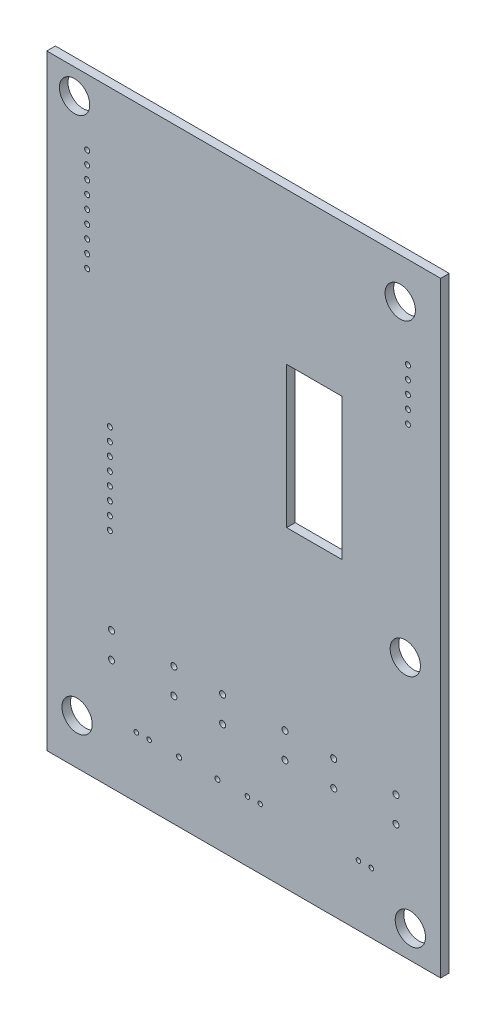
SolidWorks part; units mm, degrees
ref_plane "Plan de face" through (0, 0, 0) normal (0, 0, 1) x (1, 0, 0)
ref_plane "Plan de dessus" through (0, 0, 0) normal (0, 1, 0) x (1, 0, 0)
ref_plane "Plan de droite" through (0, 0, 0) normal (1, 0, 0) x (0, 0, -1)
sketch "Esquisse2" plane through (0, 0, 0) normal (0, 0, 1) x (1, 0, 0)
  line L0 (85.5, -81) -> (85.5, -53)
  line L1 (85.5, -53) -> (74.5, -53)
  line L2 (74.5, -53) -> (74.5, -81)
  line L3 (74.5, -81) -> (85.5, -81)
  line L4 (27, -143) -> (27, -23)
  line L5 (27, -23) -> (105, -23)
  line L6 (105, -23) -> (105, -143)
  line L7 (105, -143) -> (27, -143)
  circle A0 centre (97, -31) radius 3
  circle A1 centre (98.52, -41.08) radius 0.5
  circle A2 centre (98.52, -43.62) radius 0.5
  circle A3 centre (98.52, -46.16) radius 0.5
  circle A4 centre (98.52, -48.7) radius 0.5
  circle A5 centre (98.52, -51.24) radius 0.5
  circle A6 centre (32.5, -28) radius 3
  circle A7 centre (35, -36) radius 0.5
  circle A8 centre (35, -38.54) radius 0.5
  circle A9 centre (35, -41.08) radius 0.5
  circle A10 centre (35, -43.62) radius 0.5
  circle A11 centre (35, -46.16) radius 0.5
  circle A12 centre (35, -48.7) radius 0.5
  circle A13 centre (35, -51.24) radius 0.5
  circle A14 centre (35, -53.78) radius 0.5
  circle A15 centre (35, -56.32) radius 0.5
  circle A16 centre (39.49, -81.21) radius 0.5
  circle A17 centre (98, -91.5) radius 3
  circle A18 centre (96.17, -115.96) radius 0.6
  circle A19 centre (96.16, -121.04) radius 0.6
  circle A20 centre (99, -137.5) radius 3
  circle A21 centre (91.265, -131) radius 0.45
  circle A22 centre (88.725, -131) radius 0.45
  circle A23 centre (83.82, -115.95) radius 0.6
  circle A24 centre (83.83, -121.04) radius 0.6
  circle A25 centre (74.17, -115.96) radius 0.6
  circle A26 centre (74.16, -121.04) radius 0.6
  circle A27 centre (69.265, -131) radius 0.45
  circle A28 centre (66.725, -131) radius 0.45
  circle A29 centre (39.49, -83.75) radius 0.5
  circle A30 centre (39.49, -86.29) radius 0.5
  circle A31 centre (39.49, -88.83) radius 0.5
  circle A32 centre (39.49, -91.37) radius 0.5
  circle A33 centre (39.49, -93.91) radius 0.5
  circle A34 centre (39.49, -96.45) radius 0.5
  circle A35 centre (39.49, -98.99) radius 0.5
  circle A36 centre (61.82, -115.95) radius 0.6
  circle A37 centre (61.83, -121.04) radius 0.6
  circle A38 centre (52.17, -115.96) radius 0.6
  circle A39 centre (52.16, -121.04) radius 0.6
  circle A40 centre (60.8, -131) radius 0.5
  circle A41 centre (53.2, -131) radius 0.5
  circle A42 centre (39.82, -115.95) radius 0.6
  circle A43 centre (39.83, -121.04) radius 0.6
  circle A44 centre (47.265, -131) radius 0.45
  circle A45 centre (44.725, -131) radius 0.45
  circle A46 centre (33, -134) radius 3
extrude "Boss.-Extru.1" add sketch "Esquisse2" along normal blind 1.7
